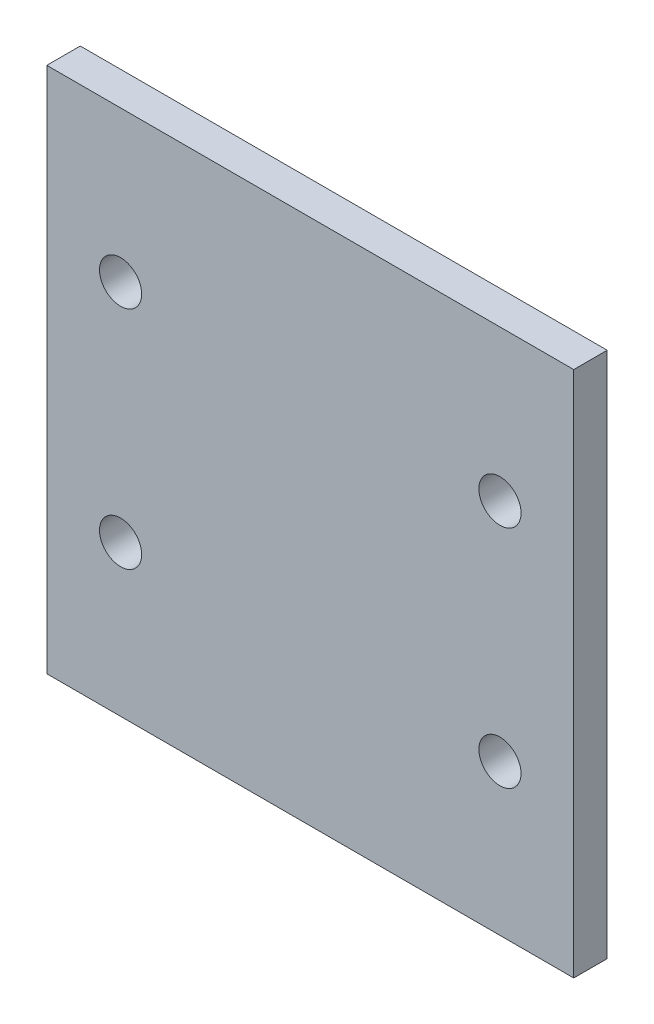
SolidWorks part; units mm, degrees
ref_plane "Plan de face" through (0, 0, 0) normal (0, 0, 1) x (1, 0, 0)
ref_plane "Plan de dessus" through (0, 0, 0) normal (0, 1, 0) x (1, 0, 0)
ref_plane "Plan de droite" through (0, 0, 0) normal (1, 0, 0) x (0, 0, -1)
sketch "Esquisse1" plane through (0, 0, 0) normal (0, 0, 1) x (1, 0, 0)
  line L1 (-12.5, -12.5) -> (12.5, -12.5)
  line L2 (-12.5, -12.5) -> (-12.5, 12.5)
  line L3 (-12.5, 12.5) -> (12.5, 12.5)
  line L4 (12.5, -12.5) -> (12.5, 12.5)
  line L5 (-12.5, -12.5) -> (12.5, 12.5) construction
  line L6 (-12.5, 12.5) -> (12.5, -12.5) construction
  line L7 (9, 5.35) -> (-9, 5.35) construction
  line L8 (9, 5.35) -> (9, -5.35) construction
  line L9 (9, -5.35) -> (-9, -5.35) construction
  line L10 (-9, 5.35) -> (-9, -5.35) construction
  line L11 (9, 5.35) -> (-9, -5.35) construction
  line L12 (9, -5.35) -> (-9, 5.35) construction
  circle A0 centre (0, 0) radius 4 construction
  circle A1 centre (-9, 5.35) radius 1
  circle A2 centre (9, 5.35) radius 1
  circle A3 centre (-9, -5.35) radius 1
  circle A4 centre (9, -5.35) radius 1
  point P0 (0, 0)
  dimension "D3" = 2
  dimension "D5" = 10.7
  dimension "D7" = 8
  dimension "D1" = 25
  dimension "D2" = 25
  dimension "D4" = 18
extrude "Boss.-Extru.1" add sketch "Esquisse1" along normal blind 1.5875
